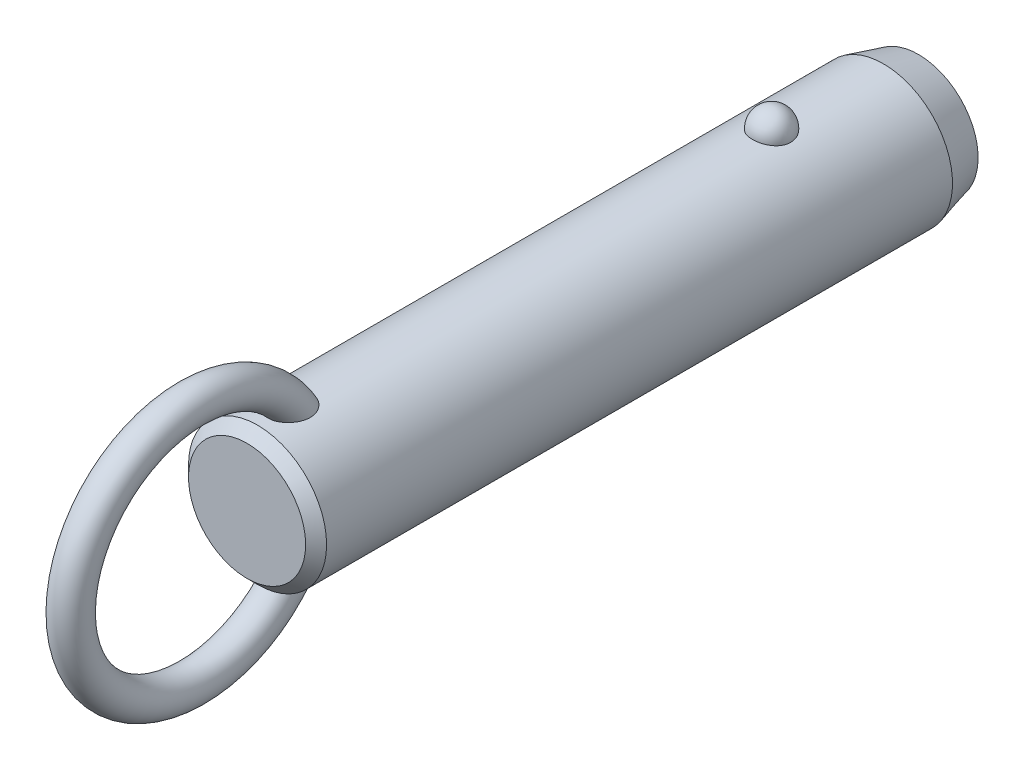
SolidWorks part; units mm, degrees
ref_plane "Front Plane" through (0, 0, 0) normal (0, 0, 1) x (1, 0, 0)
ref_plane "Top Plane" through (0, 0, 0) normal (0, 1, 0) x (1, 0, 0)
ref_plane "Right Plane" through (0, 0, 0) normal (1, 0, 0) x (0, 0, -1)
sketch "Sketch2" plane through (0, 0, 0) normal (0, 0, 1) x (1, 0, 0)
  circle A0 centre (0, 0) radius 7.9
  point P3 (0, 7.9)
  dimension "D1" = 15.8
extrude "Boss-Extrude1" add sketch "Sketch2" along normal blind 48.3
sketch "Sketch3" plane through (0, 0, 0) normal (0, 0, -1) x (-1, 0, 0)
  circle A0 centre (0, 0) radius 7.9
  dimension "D1" = 15.8
extrude "Boss-Extrude2" add sketch "Sketch3" along normal blind 19
chamfer "Chamfer1" distance 4 angle 15 1 edges at (-7.9, 0, -19)
sketch "Sketch12" plane through (0, 0, 0) normal (1, 0, 0) x (0, 0, -1)
  line L0 (-48.3, 7.9) -> (-48.3, -7.9) construction
  point P0 (-48.3, 0)
sketch "Sketch13" plane through (0, 0, 0) normal (1, 0, 0) x (0, 0, -1)
  circle A0 centre (-64.15, 0) radius 15.85
  point P2 (-48.3, 0)
  dimension "D1" = 31.7
sketch "Sketch14" plane through (0, 0, 0) normal (0, 1, 0) x (1, 0, 0)
  circle A0 centre (0, -50.3) radius 2
  point P2 (0, -48.3)
  dimension "D1" = 4
sweep "Sweep1" add profiles "Sketch14" path "Sketch13"
sketch "Sketch15" plane through (0, 0, 48.3) normal (0, 0, 1) x (1, 0, 0)
  circle A0 centre (0, 0) radius 7.9
  dimension "D1" = 15.8
extrude "Boss-Extrude3" add sketch "Sketch15" along normal blind 9.52
chamfer "Chamfer2" distance 1.2 angle 45 1 edges at (7.9, 0, 57.82)
sketch "Sketch18" plane through (0, 0, 0) normal (1, 0, 0) x (0, 0, -1)
  line L0 (15, 7.9) -> (-50.4091, 7.9) construction
  line L1 (2.2, 10.1) -> (2.2, 5.7)
  line L2 (-50.4091, -7.9) -> (15, -7.9) construction
  arc A0 (2.2, 10.1) -> (2.2, 5.7) centre (2.2, 7.9) ccw
  point P4 (0, 7.9)
  dimension "D1" = 18
revolve "Revolve1" add sketch "Sketch18" angle 360 about L1
